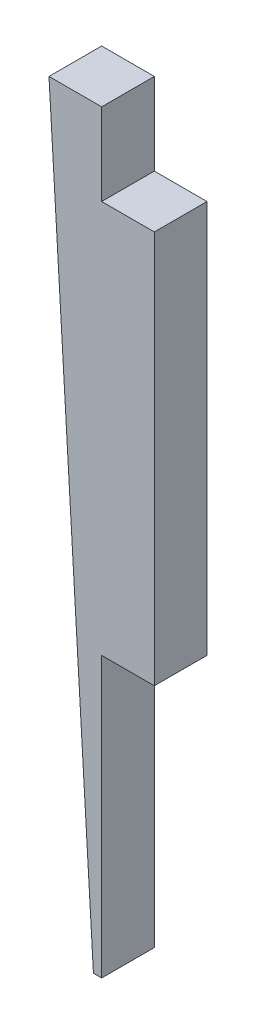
SolidWorks part; units mm, degrees
ref_plane "Front Plane" through (0, 0, 0) normal (0, 0, 1) x (1, 0, 0)
ref_plane "Top Plane" through (0, 0, 0) normal (0, 1, 0) x (1, 0, 0)
ref_plane "Right Plane" through (0, 0, 0) normal (1, 0, 0) x (0, 0, -1)
sketch "Sketch1" plane through (0, 0, 0) normal (0, 0, 1) x (1, 0, 0)
  line L0 (-1.524, -3.7695) -> (0, -3.7695)
  line L1 (0, -3.7695) -> (0, 7.6009)
  line L2 (0, 7.6009) -> (-1.524, 7.6009)
  line L3 (-1.524, 7.6009) -> (-1.524, 9.9731)
  line L4 (-1.524, -3.7695) -> (-1.524, -11.8526)
  line L5 (-1.524, 9.9731) -> (-3.048, 9.9731)
  line L6 (-3.048, 9.9731) -> (-1.7618, -11.8526)
  line L7 (-1.524, -11.8526) -> (-1.7618, -11.8526)
extrude "Boss-Extrude1" add sketch "Sketch1" along normal blind 1.524
